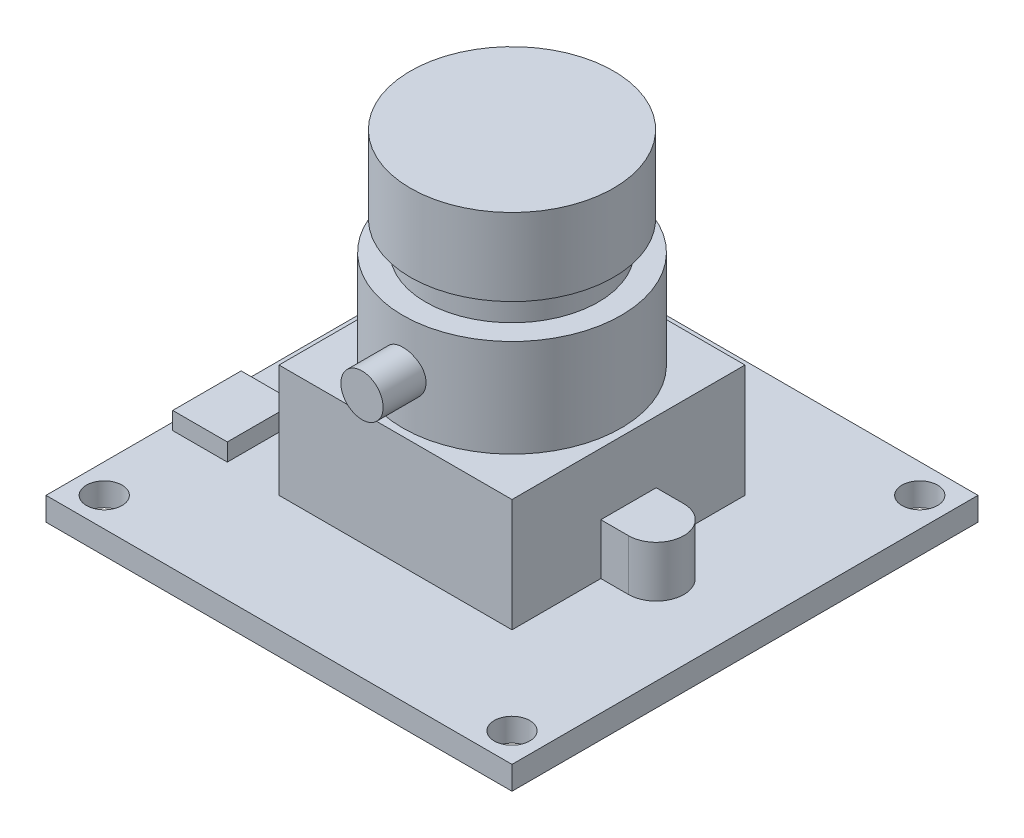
SolidWorks part; units mm, degrees
ref_plane "Front Plane" through (0, 0, 0) normal (0, 0, 1) x (1, 0, 0)
ref_plane "Top Plane" through (0, 0, 0) normal (0, 1, 0) x (1, 0, 0)
ref_plane "Right Plane" through (0, 0, 0) normal (1, 0, 0) x (0, 0, -1)
sketch "Sketch1" plane through (0, 0, 0) normal (0, 1, 0) x (1, 0, 0)
  line L0 (2, 30) -> (0, 30) construction
  line L1 (0, 0) -> (32, 0)
  line L2 (0, 0) -> (0, 32)
  line L3 (0, 32) -> (32, 32)
  line L4 (32, 0) -> (32, 32)
  line L5 (2, 30) -> (2, 32) construction
  line L6 (2, 2) -> (2, 0) construction
  line L7 (30, 30) -> (32, 30) construction
  circle A0 centre (2, 30) radius 1.22
  circle A1 centre (2, 2) radius 1.22
  circle A2 centre (30, 2) radius 1.22
  circle A3 centre (30, 30) radius 1.22
  dimension "D1" = 2.44
  dimension "D2" = 32
  dimension "D3" = 32
  dimension "D4" = 2
extrude "Boss-Extrude1" add sketch "Sketch1" along normal blind 1.6
sketch "Sketch2" plane through (0, 1.6, 0) normal (0, 1, 0) x (1, 0, 0)
  line L0 (16, 32) -> (16, 24) construction
  line L1 (8, 24) -> (24, 24)
  line L2 (8, 24) -> (8, 8)
  line L3 (8, 8) -> (24, 8)
  line L4 (24, 24) -> (24, 8)
  line L5 (32, 32) -> (0, 32) construction
  line L6 (24, 16) -> (32, 16) construction
  line L7 (32, 0) -> (32, 32) construction
  dimension "D1" = 16
  dimension "D2" = 16
extrude "Boss-Extrude2" add sketch "Sketch2" along normal blind 7.75
sketch "Sketch3" plane through (0, 9.35, 0) normal (0, 1, 0) x (1, 0, 0)
  line L0 (8, 24) -> (24, 8) construction
  line L1 (8, 24) -> (8, 8) construction
  line L2 (8, 24) -> (8, 8) construction
  line L3 (24, 24) -> (8, 24) construction
  circle A0 centre (16, 16) radius 7.5
  dimension "D1" = 15
extrude "Boss-Extrude3" add sketch "Sketch3" along normal blind 6.7
sketch "Sketch4" plane through (0, 16.05, 0) normal (0, 1, 0) x (1, 0, 0)
  circle A0 centre (16, 16) radius 5.925
  dimension "D1" = 11.85
extrude "Boss-Extrude4" add sketch "Sketch4" along normal blind 2
sketch "Sketch5" plane through (0, 18.05, 0) normal (0, 1, 0) x (-1, 0, 0)
  circle A0 centre (-16, -16) radius 6.975
  dimension "D1" = 13.95
extrude "Boss-Extrude5" add sketch "Sketch5" along normal blind 5.3
ref_plane "Plane1" through (0, 0, -8.5) normal (0, 0, 1) x (1, 0, 0)
sketch "Sketch6" plane through (0, 0, -8.5) normal (0, 0, 1) x (1, 0, 0)
  line L0 (8, 9.35) -> (24, 9.35) construction
  line L1 (16, 9.35) -> (16, 12.7) construction
  circle A0 centre (16, 12.7) radius 1.45
  dimension "D1" = 3.35
  dimension "D2" = 2.9
extrude "Boss-Extrude6" add sketch "Sketch6" along normal blind 2.8 and the other way blind 2.8 separate body
sketch "Sketch7" plane through (0, 1.6, 0) normal (0, 1, 0) x (1, 0, 0)
  line L0 (0, 16) -> (32, 16) construction
  line L1 (0, 32) -> (0, 0) construction
  line L2 (32, 0) -> (32, 32) construction
  line L3 (8, 24) -> (8, 8) construction
  line L4 (24, 8) -> (24, 24) construction
  line L5 (6.1, 17.9) -> (8, 17.9)
  line L6 (8, 17.9) -> (8, 14.1)
  line L7 (8, 24) -> (8, 8) construction
  line L8 (8, 14.1) -> (6.1, 14.1)
  line L9 (25.9, 17.9) -> (24, 17.9)
  line L10 (24, 8) -> (24, 24) construction
  line L11 (24, 17.9) -> (24, 14.1)
  line L12 (24, 14.1) -> (25.9, 14.1)
  arc A0 (6.1, 17.9) -> (6.1, 14.1) centre (6.1, 16) ccw
  arc A1 (25.9, 14.1) -> (25.9, 17.9) centre (25.9, 16) ccw
  dimension "D1" = 3.8
extrude "Boss-Extrude7" add sketch "Sketch7" along normal blind 3.5
sketch "Sketch8" plane through (0, 1.6, 0) normal (0, 1, 0) x (1, 0, 0)
  line L0 (0, 32) -> (0, 0) construction
  line L1 (4.25, 8.2) -> (0.5, 8.2)
  line L2 (4.25, 8.2) -> (4.25, 12.9)
  line L3 (4.25, 12.9) -> (0.5, 12.9)
  line L4 (0.5, 8.2) -> (0.5, 12.9)
  line L5 (0, 0) -> (32, 0) construction
  dimension "D1" = 4.7
  dimension "D2" = 3.75
  dimension "D3" = 0.5
  dimension "D4" = 8.2
extrude "Boss-Extrude8" add sketch "Sketch8" along normal blind 1.2
sketch "Sketch9" plane through (0, 0, 0) normal (0, -1, 0) x (-1, 0, 0)
  line L0 (0, 32) -> (0, 0) construction
  line L1 (-5.9, 27.05) -> (-15.9, 27.05)
  line L2 (-5.9, 27.05) -> (-5.9, 31.75)
  line L3 (-5.9, 31.75) -> (-15.9, 31.75)
  line L4 (-15.9, 27.05) -> (-15.9, 31.75)
  line L5 (-32, 32) -> (0, 32) construction
  dimension "D1" = 4.7
  dimension "D2" = 10
  dimension "D3" = 5.9
  dimension "D4" = 0.25
extrude "Boss-Extrude9" add sketch "Sketch9" along normal blind 6
